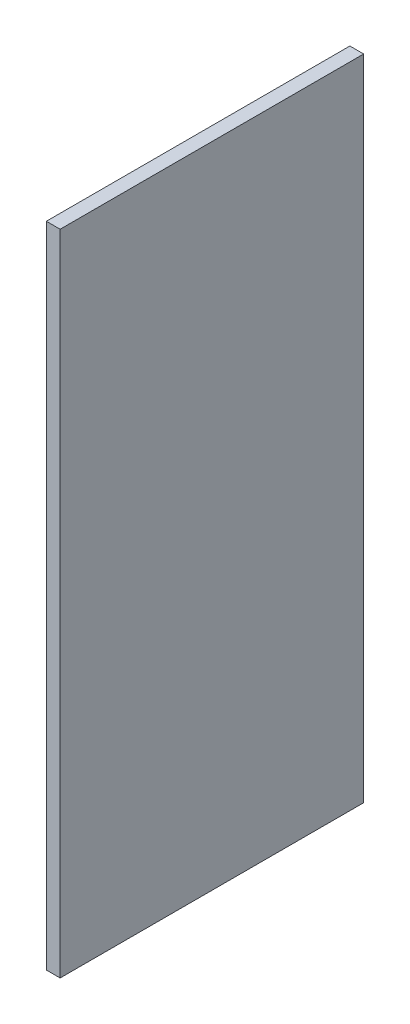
SolidWorks part; units mm, degrees
ref_plane "Face" through (0, 0, 0) normal (0, 0, 1) x (1, 0, 0)
ref_plane "Dessus" through (0, 0, 0) normal (0, 1, 0) x (1, 0, 0)
ref_plane "Droite" through (0, 0, 0) normal (1, 0, 0) x (0, 0, -1)
sketch "Esquisse1" plane through (0, 0, 0) normal (0, 0, 1) x (1, 0, 0)
  line L1 (-31.7832, 63.5664) -> (-26.7832, 63.5664)
  line L2 (-31.7832, 63.5664) -> (-31.7832, -171.4336)
  line L3 (-31.7832, -171.4336) -> (-26.7832, -171.4336)
  line L4 (-26.7832, 63.5664) -> (-26.7832, -171.4336)
  dimension "D1" = 5
  dimension "D2" = 235
extrude "Base-Extrusion" add sketch "Esquisse1" along normal blind 110
